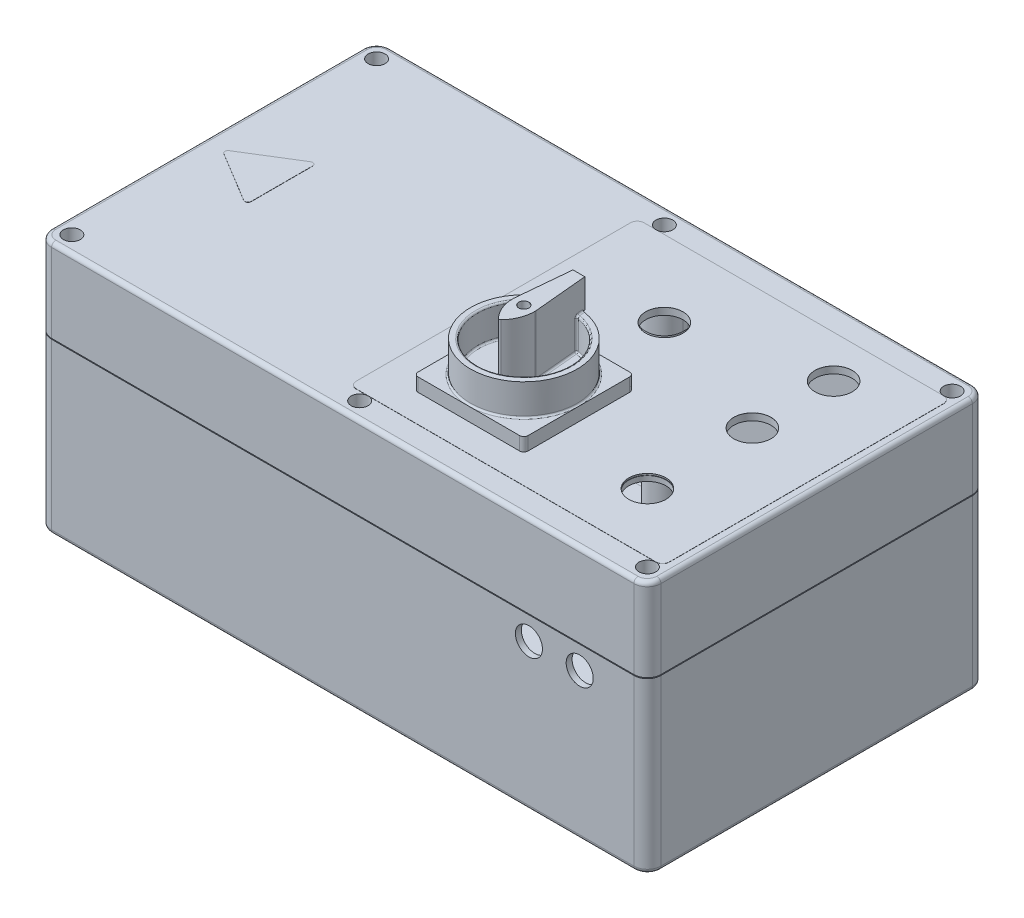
SolidWorks part; units mm, degrees
ref_plane "Plan de face" through (0, 0, 0) normal (0, 0, 1) x (1, 0, 0)
ref_plane "Plan de dessus" through (0, 0, 0) normal (0, 1, 0) x (1, 0, 0)
ref_plane "Plan de droite" through (0, 0, 0) normal (1, 0, 0) x (0, 0, -1)
imported_body "Stock-PMDPRO-5s2-1"
imported_body "Stock-PMDPRO-5s2-2"
sketch "Esquisse1" plane through (0, 40, 0) normal (0, 1, 0) x (1, 0, 0)
  line L4 (181, -346.9491) -> (525, -346.9491)
  line L5 (533, -338.9491) -> (533, -154.9491)
  line L6 (525, -146.9491) -> (181, -146.9491)
  line L7 (173, -154.9491) -> (173, -338.9491)
  line L8 (181, -346.9491) -> (525, -346.9491)
  line L9 (533, -338.9491) -> (533, -154.9491)
  line L10 (525, -146.9491) -> (181, -146.9491)
  line L11 (173, -154.9491) -> (173, -338.9491)
  arc A4 (173, -338.9491) -> (181, -346.9491) centre (181, -338.9491) ccw
  arc A5 (525, -346.9491) -> (533, -338.9491) centre (525, -338.9491) ccw
  arc A6 (533, -154.9491) -> (525, -146.9491) centre (525, -154.9491) ccw
  arc A7 (181, -146.9491) -> (173, -154.9491) centre (181, -154.9491) ccw
  arc A8 (173, -338.9491) -> (181, -346.9491) centre (181, -338.9491) ccw
  arc A9 (525, -346.9491) -> (533, -338.9491) centre (525, -338.9491) ccw
  arc A10 (533, -154.9491) -> (525, -146.9491) centre (525, -154.9491) ccw
  arc A11 (181, -146.9491) -> (173, -154.9491) centre (181, -154.9491) ccw
  dimension "D1" = 0
extrude "Enlèv. mat.-Extru.1" cut sketch "Esquisse1" along normal up to vertex
sketch "Esquisse2" plane through (0, 40, 0) normal (0, 1, 0) x (1, 0, 0)
  line L0 (362.5, -156.9491) -> (362.5, -153.9491)
  line L1 (366, -150.4491) -> (509.5, -150.4491)
  line L2 (513, -153.9491) -> (513, -167.4491)
  line L3 (522.5, -176.9491) -> (526, -176.9491)
  line L4 (529.5, -180.4491) -> (529.5, -313.4491)
  line L5 (525, -146.9491) -> (181, -146.9491) construction
  line L6 (533, -338.9491) -> (533, -154.9491) construction
  line L7 (353, -156.9491) -> (353, -246.9491) construction
  line L8 (353, -246.9491) -> (533, -246.9491) construction
  line L9 (183.5, -176.9491) -> (180, -176.9491)
  line L10 (193, -153.9491) -> (193, -167.4491)
  line L11 (340, -150.4491) -> (196.5, -150.4491)
  line L12 (343.5, -156.9491) -> (343.5, -153.9491)
  line L13 (343.5, -336.9491) -> (343.5, -339.9491)
  line L14 (340, -343.4491) -> (196.5, -343.4491)
  line L15 (193, -339.9491) -> (193, -326.4491)
  line L16 (183.5, -316.9491) -> (180, -316.9491)
  line L17 (522.5, -316.9491) -> (526, -316.9491)
  line L18 (513, -339.9491) -> (513, -326.4491)
  line L19 (366, -343.4491) -> (509.5, -343.4491)
  line L20 (362.5, -336.9491) -> (362.5, -339.9491)
  line L21 (176.5, -180.4491) -> (176.5, -313.4491)
  arc A0 (343.5, -156.9491) -> (362.5, -156.9491) centre (353, -156.9491) ccw
  arc A1 (362.5, -153.9491) -> (366, -150.4491) centre (366, -153.9491) cw
  arc A2 (526, -176.9491) -> (529.5, -180.4491) centre (526, -180.4491) cw
  arc A3 (509.5, -150.4491) -> (513, -153.9491) centre (509.5, -153.9491) cw
  arc A4 (513, -167.4491) -> (522.5, -176.9491) centre (522.5, -167.4491) ccw
  circle A5 centre (523, -156.9491) radius 3
  circle A6 centre (183, -156.9491) radius 3
  arc A7 (193, -167.4491) -> (183.5, -176.9491) centre (183.5, -167.4491) cw
  arc A8 (196.5, -150.4491) -> (193, -153.9491) centre (196.5, -153.9491) ccw
  arc A9 (180, -176.9491) -> (176.5, -180.4491) centre (180, -180.4491) ccw
  arc A10 (343.5, -153.9491) -> (340, -150.4491) centre (340, -153.9491) ccw
  circle A11 centre (353, -156.9491) radius 3
  circle A12 centre (353, -336.9491) radius 3
  arc A13 (343.5, -339.9491) -> (340, -343.4491) centre (340, -339.9491) cw
  arc A14 (180, -316.9491) -> (176.5, -313.4491) centre (180, -313.4491) cw
  arc A15 (196.5, -343.4491) -> (193, -339.9491) centre (196.5, -339.9491) cw
  arc A16 (193, -326.4491) -> (183.5, -316.9491) centre (183.5, -326.4491) ccw
  circle A17 centre (183, -336.9491) radius 3
  circle A18 centre (523, -336.9491) radius 3
  arc A19 (513, -326.4491) -> (522.5, -316.9491) centre (522.5, -326.4491) cw
  arc A20 (509.5, -343.4491) -> (513, -339.9491) centre (509.5, -339.9491) ccw
  arc A21 (526, -316.9491) -> (529.5, -313.4491) centre (526, -313.4491) ccw
  arc A22 (362.5, -339.9491) -> (366, -343.4491) centre (366, -339.9491) ccw
  arc A23 (343.5, -336.9491) -> (362.5, -336.9491) centre (353, -336.9491) cw
  dimension "D2" = 3.5
  dimension "D5" = 19
  dimension "D9" = 3.5
  dimension "D10" = 9.5
  dimension "D11" = 6
  dimension "D1" = 160
  dimension "D3" = 3.5
  dimension "D4" = 180
  dimension "D6" = 10
  dimension "D7" = 30
  dimension "D8" = 3.5
  dimension "D12" = 10
  dimension "D13" = 10
extrude "Enlèv. mat.-Extru.2" cut sketch "Esquisse2" against normal blind 96.5
sketch "Esquisse3" plane through (0, 40, 0) normal (0, 1, 0) x (1, 0, 0)
  line L0 (529.5, -180.4491) -> (529.5, -313.4491) construction
  line L1 (522.5, -176.9491) -> (526, -176.9491) construction
  line L2 (513, -153.9491) -> (513, -167.4491) construction
  line L3 (366, -150.4491) -> (509.5, -150.4491) construction
  line L4 (362.5, -156.9491) -> (362.5, -153.9491) construction
  line L5 (343.5, -156.9491) -> (343.5, -153.9491) construction
  line L6 (340, -150.4491) -> (196.5, -150.4491) construction
  line L7 (193, -153.9491) -> (193, -167.4491) construction
  line L8 (183.5, -176.9491) -> (180, -176.9491) construction
  line L9 (176.5, -180.4491) -> (176.5, -313.4491) construction
  line L10 (183.5, -316.9491) -> (180, -316.9491) construction
  line L11 (193, -339.9491) -> (193, -326.4491) construction
  line L12 (340, -343.4491) -> (196.5, -343.4491) construction
  line L13 (343.5, -336.9491) -> (343.5, -339.9491) construction
  line L14 (362.5, -336.9491) -> (362.5, -339.9491) construction
  line L15 (366, -343.4491) -> (509.5, -343.4491) construction
  line L16 (513, -339.9491) -> (513, -326.4491) construction
  line L17 (522.5, -316.9491) -> (526, -316.9491) construction
  line L18 (529.5, -180.4491) -> (529.5, -313.4491)
  line L19 (522.5, -176.9491) -> (526, -176.9491)
  line L20 (513, -153.9491) -> (513, -167.4491)
  line L21 (366, -150.4491) -> (509.5, -150.4491)
  line L22 (362.5, -156.9491) -> (362.5, -153.9491)
  line L23 (343.5, -156.9491) -> (343.5, -153.9491)
  line L24 (340, -150.4491) -> (196.5, -150.4491)
  line L25 (193, -153.9491) -> (193, -167.4491)
  line L26 (183.5, -176.9491) -> (180, -176.9491)
  line L27 (176.5, -180.4491) -> (176.5, -313.4491)
  line L28 (183.5, -316.9491) -> (180, -316.9491)
  line L29 (193, -339.9491) -> (193, -326.4491)
  line L30 (340, -343.4491) -> (196.5, -343.4491)
  line L31 (343.5, -336.9491) -> (343.5, -339.9491)
  line L32 (362.5, -336.9491) -> (362.5, -339.9491)
  line L33 (366, -343.4491) -> (509.5, -343.4491)
  line L34 (513, -339.9491) -> (513, -326.4491)
  line L35 (522.5, -316.9491) -> (526, -316.9491)
  line L36 (530.5, -180.4491) -> (530.5, -313.4491)
  line L37 (522.5, -317.9491) -> (526, -317.9491)
  line L38 (514, -339.9491) -> (514, -326.4491)
  line L39 (366, -344.4491) -> (509.5, -344.4491)
  line L40 (361.5, -336.9491) -> (361.5, -339.9491)
  line L41 (344.5, -336.9491) -> (344.5, -339.9491)
  line L42 (340, -344.4491) -> (196.5, -344.4491)
  line L43 (192, -339.9491) -> (192, -326.4491)
  line L44 (183.5, -317.9491) -> (180, -317.9491)
  line L45 (175.5, -180.4491) -> (175.5, -313.4491)
  line L46 (183.5, -175.9491) -> (180, -175.9491)
  line L47 (192, -153.9491) -> (192, -167.4491)
  line L48 (340, -149.4491) -> (196.5, -149.4491)
  line L49 (344.5, -156.9491) -> (344.5, -153.9491)
  line L50 (361.5, -156.9491) -> (361.5, -153.9491)
  line L51 (366, -149.4491) -> (509.5, -149.4491)
  line L52 (514, -153.9491) -> (514, -167.4491)
  line L53 (522.5, -175.9491) -> (526, -175.9491)
  arc A6 (529.5, -180.4491) -> (526, -176.9491) centre (526, -180.4491) ccw construction
  arc A7 (513, -167.4491) -> (522.5, -176.9491) centre (522.5, -167.4491) ccw construction
  arc A8 (513, -153.9491) -> (509.5, -150.4491) centre (509.5, -153.9491) ccw construction
  arc A9 (366, -150.4491) -> (362.5, -153.9491) centre (366, -153.9491) ccw construction
  arc A10 (343.5, -156.9491) -> (362.5, -156.9491) centre (353, -156.9491) ccw construction
  arc A11 (343.5, -153.9491) -> (340, -150.4491) centre (340, -153.9491) ccw construction
  arc A12 (196.5, -150.4491) -> (193, -153.9491) centre (196.5, -153.9491) ccw construction
  arc A13 (183.5, -176.9491) -> (193, -167.4491) centre (183.5, -167.4491) ccw construction
  arc A14 (180, -176.9491) -> (176.5, -180.4491) centre (180, -180.4491) ccw construction
  arc A15 (176.5, -313.4491) -> (180, -316.9491) centre (180, -313.4491) ccw construction
  arc A16 (193, -326.4491) -> (183.5, -316.9491) centre (183.5, -326.4491) ccw construction
  arc A17 (193, -339.9491) -> (196.5, -343.4491) centre (196.5, -339.9491) ccw construction
  arc A18 (340, -343.4491) -> (343.5, -339.9491) centre (340, -339.9491) ccw construction
  arc A19 (362.5, -336.9491) -> (343.5, -336.9491) centre (353, -336.9491) ccw construction
  arc A20 (362.5, -339.9491) -> (366, -343.4491) centre (366, -339.9491) ccw construction
  arc A21 (509.5, -343.4491) -> (513, -339.9491) centre (509.5, -339.9491) ccw construction
  arc A22 (522.5, -316.9491) -> (513, -326.4491) centre (522.5, -326.4491) ccw construction
  arc A23 (526, -316.9491) -> (529.5, -313.4491) centre (526, -313.4491) ccw construction
  arc A24 (526, -317.9491) -> (530.5, -313.4491) centre (526, -313.4491) ccw
  arc A25 (522.5, -317.9491) -> (514, -326.4491) centre (522.5, -326.4491) ccw
  arc A26 (509.5, -344.4491) -> (514, -339.9491) centre (509.5, -339.9491) ccw
  arc A27 (361.5, -339.9491) -> (366, -344.4491) centre (366, -339.9491) ccw
  arc A28 (361.5, -336.9491) -> (344.5, -336.9491) centre (353, -336.9491) ccw
  arc A29 (340, -344.4491) -> (344.5, -339.9491) centre (340, -339.9491) ccw
  arc A30 (529.5, -180.4491) -> (526, -176.9491) centre (526, -180.4491) ccw
  arc A31 (513, -167.4491) -> (522.5, -176.9491) centre (522.5, -167.4491) ccw
  arc A32 (513, -153.9491) -> (509.5, -150.4491) centre (509.5, -153.9491) ccw
  arc A33 (366, -150.4491) -> (362.5, -153.9491) centre (366, -153.9491) ccw
  arc A34 (343.5, -156.9491) -> (362.5, -156.9491) centre (353, -156.9491) ccw
  arc A35 (343.5, -153.9491) -> (340, -150.4491) centre (340, -153.9491) ccw
  arc A36 (196.5, -150.4491) -> (193, -153.9491) centre (196.5, -153.9491) ccw
  arc A37 (183.5, -176.9491) -> (193, -167.4491) centre (183.5, -167.4491) ccw
  arc A38 (180, -176.9491) -> (176.5, -180.4491) centre (180, -180.4491) ccw
  arc A39 (176.5, -313.4491) -> (180, -316.9491) centre (180, -313.4491) ccw
  arc A40 (193, -326.4491) -> (183.5, -316.9491) centre (183.5, -326.4491) ccw
  arc A41 (193, -339.9491) -> (196.5, -343.4491) centre (196.5, -339.9491) ccw
  arc A42 (340, -343.4491) -> (343.5, -339.9491) centre (340, -339.9491) ccw
  arc A43 (362.5, -336.9491) -> (343.5, -336.9491) centre (353, -336.9491) ccw
  arc A44 (362.5, -339.9491) -> (366, -343.4491) centre (366, -339.9491) ccw
  arc A45 (509.5, -343.4491) -> (513, -339.9491) centre (509.5, -339.9491) ccw
  arc A46 (522.5, -316.9491) -> (513, -326.4491) centre (522.5, -326.4491) ccw
  arc A47 (526, -316.9491) -> (529.5, -313.4491) centre (526, -313.4491) ccw
  arc A48 (192, -339.9491) -> (196.5, -344.4491) centre (196.5, -339.9491) ccw
  arc A49 (192, -326.4491) -> (183.5, -317.9491) centre (183.5, -326.4491) ccw
  arc A50 (175.5, -313.4491) -> (180, -317.9491) centre (180, -313.4491) ccw
  arc A51 (180, -175.9491) -> (175.5, -180.4491) centre (180, -180.4491) ccw
  arc A52 (183.5, -175.9491) -> (192, -167.4491) centre (183.5, -167.4491) ccw
  arc A53 (196.5, -149.4491) -> (192, -153.9491) centre (196.5, -153.9491) ccw
  arc A54 (344.5, -153.9491) -> (340, -149.4491) centre (340, -153.9491) ccw
  arc A55 (344.5, -156.9491) -> (361.5, -156.9491) centre (353, -156.9491) ccw
  arc A56 (366, -149.4491) -> (361.5, -153.9491) centre (366, -153.9491) ccw
  arc A57 (514, -153.9491) -> (509.5, -149.4491) centre (509.5, -153.9491) ccw
  arc A58 (514, -167.4491) -> (522.5, -175.9491) centre (522.5, -167.4491) ccw
  arc A59 (530.5, -180.4491) -> (526, -175.9491) centre (526, -180.4491) ccw
  dimension "D1" = 1
extrude "Boss.-Extru.1" add sketch "Esquisse3" along normal blind 1.5
sketch "Esquisse4" plane through (0, 40, 0) normal (0, 1, 0) x (1, 0, 0)
  line L0 (533, -338.9491) -> (533, -154.9491) construction
  line L1 (525, -146.9491) -> (181, -146.9491) construction
  line L2 (522.5, -173.7491) -> (528.5, -173.7491)
  line L3 (529.5, -172.7491) -> (529.5, -162.7586)
  line L5 (516.2, -167.4491) -> (516.2, -162.4591)
  line L6 (353, -159.9491) -> (353, -246.9491) construction
  line L7 (529.5, -246.9491) -> (353, -246.9491) construction
  line L8 (529.5, -313.4491) -> (529.5, -180.4491) construction
  line L9 (516.2, -326.4491) -> (516.2, -331.4391)
  line L10 (529.5, -321.1491) -> (529.5, -331.1396)
  line L11 (522.5, -320.1491) -> (528.5, -320.1491)
  line L12 (183.5, -320.1491) -> (177.5, -320.1491)
  line L13 (176.5, -321.1491) -> (176.5, -331.1396)
  line L14 (189.8, -326.4491) -> (189.8, -331.4391)
  line L15 (189.8, -167.4491) -> (189.8, -162.4591)
  line L16 (176.5, -172.7491) -> (176.5, -162.7586)
  line L17 (183.5, -173.7491) -> (177.5, -173.7491)
  arc A0 (517.925, -161.7703) -> (527.8125, -162.0324) centre (523, -156.9491) ccw
  circle A1 centre (523, -168.9491) radius 4.7 construction
  arc A3 (529.5, -172.7491) -> (528.5, -173.7491) centre (528.5, -172.7491) cw
  arc A4 (516.2, -167.4491) -> (522.5, -173.7491) centre (522.5, -167.4491) ccw
  arc A5 (516.2, -167.4491) -> (522.5, -173.7491) centre (522.5, -167.4491) ccw
  arc A6 (529.5, -162.7586) -> (527.8125, -162.0324) centre (528.5, -162.7586) ccw
  arc A7 (516.2, -162.4591) -> (517.925, -161.7703) centre (517.2, -162.4591) cw
  circle A8 centre (353, -156.9491) radius 3 construction
  circle A9 centre (353, -156.9491) radius 3 construction
  circle A11 centre (523, -324.9491) radius 4.7 construction
  arc A12 (516.2, -331.4391) -> (517.925, -332.1279) centre (517.2, -331.4391) ccw
  arc A13 (529.5, -331.1396) -> (527.8125, -331.8658) centre (528.5, -331.1396) cw
  arc A14 (516.2, -326.4491) -> (522.5, -320.1491) centre (522.5, -326.4491) cw
  arc A15 (529.5, -321.1491) -> (528.5, -320.1491) centre (528.5, -321.1491) ccw
  arc A16 (517.925, -332.1279) -> (527.8125, -331.8658) centre (523, -336.9491) cw
  circle A17 centre (183, -324.9491) radius 4.7 construction
  circle A18 centre (183, -168.9491) radius 4.7 construction
  arc A19 (188.075, -332.1279) -> (178.1875, -331.8658) centre (183, -336.9491) ccw
  arc A20 (176.5, -321.1491) -> (177.5, -320.1491) centre (177.5, -321.1491) cw
  arc A21 (189.8, -326.4491) -> (183.5, -320.1491) centre (183.5, -326.4491) ccw
  arc A22 (176.5, -331.1396) -> (178.1875, -331.8658) centre (177.5, -331.1396) ccw
  arc A23 (189.8, -331.4391) -> (188.075, -332.1279) centre (188.8, -331.4391) cw
  arc A24 (189.8, -162.4591) -> (188.075, -161.7703) centre (188.8, -162.4591) ccw
  arc A25 (176.5, -162.7586) -> (178.1875, -162.0324) centre (177.5, -162.7586) cw
  arc A26 (189.8, -167.4491) -> (183.5, -173.7491) centre (183.5, -167.4491) cw
  arc A27 (176.5, -172.7491) -> (177.5, -173.7491) centre (177.5, -172.7491) ccw
  arc A28 (188.075, -161.7703) -> (178.1875, -162.0324) centre (183, -156.9491) cw
  dimension "D1" = 9.4
  dimension "D5" = 14
  dimension "D6" = 1
  dimension "D8" = 1
  dimension "D9" = 1
  dimension "D2" = 10
  dimension "D3" = 22
  dimension "D7" = 3.5
  dimension "D4" = 3.2
extrude "Enlèv. mat.-Extru.3" cut sketch "Esquisse4" against normal blind 90
sketch "Esquisse5" plane through (0, -60, 0) normal (0, -1, 0) x (1, 0, 0)
  circle A0 centre (183, 168.9491) radius 5.5
  circle A1 centre (183, 168.9491) radius 3.25 construction
  circle A2 centre (183, 168.9491) radius 3.25
  circle A3 centre (183, 324.9491) radius 3.25 construction
  circle A4 centre (523, 324.9491) radius 3.25 construction
  circle A5 centre (523, 168.9491) radius 3.25 construction
  circle A6 centre (183, 324.9491) radius 3.25
  circle A7 centre (523, 324.9491) radius 3.25
  circle A8 centre (523, 168.9491) radius 3.25
  circle A9 centre (523, 324.9491) radius 5.5
  circle A10 centre (183, 324.9491) radius 5.5
  circle A11 centre (523, 168.9491) radius 5.5
  dimension "D1" = 11
extrude "Boss.-Extru.2" add sketch "Esquisse5" along normal blind 1.25
sketch "Esquisse6" plane through (0, -56.5, 0) normal (0, 1, 0) x (1, 0, 0)
  line L0 (353, -165.4491) -> (353, -328.4491) construction
  line L1 (525, -146.9491) -> (181, -146.9491) construction
  circle A0 centre (518, -206.9491) radius 2.75 construction
  circle A1 centre (503.5, -160.9491) radius 2.75 construction
  circle A2 centre (518, -246.9491) radius 2.75 construction
  circle A3 centre (518, -286.9491) radius 2.75 construction
  circle A4 centre (503.5, -332.9491) radius 2.75 construction
  circle A5 centre (518, -206.9491) radius 2.75
  circle A6 centre (503.5, -160.9491) radius 2.75
  circle A7 centre (518, -246.9491) radius 2.75
  circle A8 centre (518, -286.9491) radius 2.75
  circle A9 centre (503.5, -332.9491) radius 2.75
  circle A10 centre (503.5, -160.9491) radius 5.75
  circle A11 centre (518, -206.9491) radius 5.75
  circle A12 centre (518, -246.9491) radius 5.75
  circle A13 centre (518, -286.9491) radius 5.75
  circle A14 centre (503.5, -332.9491) radius 5.75
  circle A15 centre (518, -237.9491) radius 1.5
  circle A16 centre (518, -255.9491) radius 1.5
  arc A17 (344.5, -156.9491) -> (361.5, -156.9491) centre (353, -156.9491) ccw construction
  arc A18 (361.5, -336.9491) -> (344.5, -336.9491) centre (353, -336.9491) ccw construction
  circle A19 centre (188, -255.9491) radius 1.5
  circle A20 centre (188, -237.9491) radius 1.5
  circle A21 centre (202.5, -332.9491) radius 5.75
  circle A22 centre (188, -286.9491) radius 5.75
  circle A23 centre (188, -246.9491) radius 5.75
  circle A24 centre (188, -206.9491) radius 5.75
  circle A25 centre (202.5, -160.9491) radius 5.75
  circle A26 centre (202.5, -332.9491) radius 2.75
  circle A27 centre (188, -286.9491) radius 2.75
  circle A28 centre (188, -246.9491) radius 2.75
  circle A29 centre (202.5, -160.9491) radius 2.75
  circle A30 centre (188, -206.9491) radius 2.75
  circle A31 centre (353, -176.9491) radius 1.5
  circle A32 centre (353, -316.9491) radius 1.5
  dimension "D1" = 11.5
  dimension "D4" = 3
  dimension "D5" = 3
  dimension "D8" = 3
  dimension "D9" = 3
  dimension "D2" = 9
  dimension "D3" = 9
  dimension "D6" = 140
  dimension "D7" = 30
extrude "Boss.-Extru.3" add sketch "Esquisse6" along normal blind 10
fillet "Congé1" radius 1 52 edges at (353, -56.5, 315.4491) (202.5, -56.5, 155.1991) (188, -56.5, 241.1991) (202.5, -56.5, 327.1991) (188, -56.5, 254.4491) (518, -56.5, 236.4491) (518, -56.5, 281.1991) (518, -56.5, 201.1991) (529.5, -56.5, 246.9491) (528.4749, -56.5, 315.924) (524.25, -56.5, 316.9491) (515.7825, -56.5, 319.7316) (513, -56.5, 333.1991) (511.9749, -56.5, 342.424) (437.75, -56.5, 343.4491) (363.5251, -56.5, 342.424) (362.5, -56.5, 338.4491) (353, -56.5, 327.4491) (343.5, -56.5, 338.4491) (342.4749, -56.5, 342.424) (268.25, -56.5, 343.4491) (194.0251, -56.5, 342.424) (193, -56.5, 333.1991) (190.2175, -56.5, 319.7316) (181.75, -56.5, 316.9491) (177.5251, -56.5, 315.924) (176.5, -56.5, 246.9491) (177.5251, -56.5, 177.9742) (181.75, -56.5, 176.9491) (190.2175, -56.5, 174.1666) (193, -56.5, 160.6991) (194.0251, -56.5, 151.4742) (268.25, -56.5, 150.4491) (342.4749, -56.5, 151.4742) (343.5, -56.5, 155.4491) (353, -56.5, 166.4491) (362.5, -56.5, 155.4491) (363.5251, -56.5, 151.4742) (437.75, -56.5, 150.4491) (511.9749, -56.5, 151.4742) (513, -56.5, 160.6991) (515.7825, -56.5, 174.1666) (524.25, -56.5, 176.9491) (528.4749, -56.5, 177.9742) (503.5, -56.5, 155.1991) (518, -56.5, 241.1991) (503.5, -56.5, 327.1991) (518, -56.5, 254.4491) (188, -56.5, 236.4491) (188, -56.5, 281.1991) (188, -56.5, 201.1991) (353, -56.5, 175.4491)
sketch "Esquisse7" plane through (0, 89.5, 0) normal (0, 1, 0) x (1, 0, 0)
  line L0 (483, -186.9491) -> (483, -234.9491) construction
  line L1 (525, -146.9491) -> (181, -146.9491) construction
  line L2 (466, -171.9491) -> (506, -171.9491) construction
  line L3 (466, -171.9491) -> (466, -201.9491) construction
  line L4 (466, -201.9491) -> (506, -201.9491) construction
  line L5 (506, -171.9491) -> (506, -201.9491) construction
  line L6 (533, -338.9491) -> (533, -154.9491) construction
  circle A0 centre (483, -296.9491) radius 11
  circle A1 centre (483, -186.9491) radius 11
  circle A2 centre (483, -234.9491) radius 11
  circle A3 centre (403, -206.9491) radius 11
  dimension "D1" = 22
  dimension "D2" = 22
  dimension "D11" = 22
  dimension "D3" = 30
  dimension "D4" = 40
  dimension "D5" = 15
  dimension "D6" = 17
  dimension "D7" = 40
  dimension "D8" = 50
  dimension "D9" = 48
  dimension "D10" = 80
  dimension "D12" = 60
extrude "Enlèv. mat.-Extru.5" cut sketch "Esquisse7" against normal blind 10
sketch "Esquisse8" plane through (0, 89.5, 0) normal (0, 1, 0) x (1, 0, 0)
  line L0 (181, -146.9491) -> (525, -146.9491) construction
  line L1 (523, -161.9491) -> (346, -161.9491)
  line L2 (527, -165.9491) -> (527, -327.9491)
  line L3 (523, -331.9491) -> (346, -331.9491)
  line L4 (342, -165.9491) -> (342, -327.9491)
  line L5 (533, -154.9491) -> (533, -338.9491) construction
  arc A0 (346, -161.9491) -> (342, -165.9491) centre (346, -165.9491) ccw
  arc A1 (346, -331.9491) -> (342, -327.9491) centre (346, -327.9491) cw
  arc A2 (527, -327.9491) -> (523, -331.9491) centre (523, -327.9491) cw
  arc A3 (523, -161.9491) -> (527, -165.9491) centre (523, -165.9491) cw
  circle A4 centre (483, -296.9491) radius 11 construction
  circle A5 centre (483, -296.9491) radius 11
  circle A6 centre (483, -186.9491) radius 11 construction
  circle A7 centre (483, -234.9491) radius 11
  circle A8 centre (483, -234.9491) radius 11
  circle A9 centre (403, -206.9491) radius 11 construction
  circle A10 centre (483, -186.9491) radius 11
  circle A11 centre (403, -206.9491) radius 11
  circle A12 centre (396, -282.9491) radius 6 construction
  circle A13 centre (378, -264.9491) radius 2.5 construction
  circle A14 centre (414, -300.9491) radius 2.5 construction
  circle A15 centre (378, -300.9491) radius 2.5 construction
  circle A16 centre (414, -264.9491) radius 2.5 construction
  circle A17 centre (396, -282.9491) radius 6
  circle A18 centre (378, -264.9491) radius 2.5
  circle A19 centre (414, -300.9491) radius 2.5
  circle A20 centre (378, -300.9491) radius 2.5
  circle A21 centre (414, -264.9491) radius 2.5
  point P10 (342, -161.9491)
  point P15 (527, -331.9491)
  point P18 (527, -161.9491)
  dimension "D5" = 4
  dimension "D1" = 185
  dimension "D2" = 170
  dimension "D3" = 15
  dimension "D4" = 6
  dimension "D6" = 0
extrude "Boss.-Extru.4" add sketch "Esquisse8" along normal blind 0.1
sketch "Esquisse9" plane through (0, 40, 0) normal (0, 1, 0) x (1, 0, 0)
  line L0 (529.5, -313.4491) -> (529.5, -180.4491)
  line L1 (526, -176.9491) -> (522.5, -176.9491)
  line L2 (513, -167.4491) -> (513, -153.9491)
  line L3 (509.5, -150.4491) -> (366, -150.4491)
  line L4 (362.5, -153.9491) -> (362.5, -156.9491)
  line L5 (343.5, -156.9491) -> (343.5, -153.9491)
  line L6 (340, -150.4491) -> (196.5, -150.4491)
  line L7 (193, -153.9491) -> (193, -167.4491)
  line L8 (183.5, -176.9491) -> (180, -176.9491)
  line L9 (176.5, -180.4491) -> (176.5, -313.4491)
  line L10 (180, -316.9491) -> (183.5, -316.9491)
  line L11 (193, -326.4491) -> (193, -339.9491)
  line L12 (196.5, -343.4491) -> (340, -343.4491)
  line L13 (343.5, -339.9491) -> (343.5, -336.9491)
  line L14 (362.5, -336.9491) -> (362.5, -339.9491)
  line L15 (366, -343.4491) -> (509.5, -343.4491)
  line L16 (513, -339.9491) -> (513, -326.4491)
  line L17 (522.5, -316.9491) -> (526, -316.9491)
  line L18 (526, -175.9491) -> (522.5, -175.9491)
  line L19 (514, -167.4491) -> (514, -153.9491)
  line L20 (509.5, -149.4491) -> (366, -149.4491)
  line L21 (361.5, -153.9491) -> (361.5, -156.9491)
  line L22 (344.5, -156.9491) -> (344.5, -153.9491)
  line L23 (340, -149.4491) -> (196.5, -149.4491)
  line L24 (192, -153.9491) -> (192, -167.4491)
  line L25 (183.5, -175.9491) -> (180, -175.9491)
  line L26 (175.5, -180.4491) -> (175.5, -313.4491)
  line L27 (180, -317.9491) -> (183.5, -317.9491)
  line L28 (192, -326.4491) -> (192, -339.9491)
  line L29 (196.5, -344.4491) -> (340, -344.4491)
  line L30 (344.5, -339.9491) -> (344.5, -336.9491)
  line L31 (361.5, -336.9491) -> (361.5, -339.9491)
  line L32 (366, -344.4491) -> (509.5, -344.4491)
  line L33 (514, -339.9491) -> (514, -326.4491)
  line L34 (522.5, -317.9491) -> (526, -317.9491)
  line L35 (530.5, -313.4491) -> (530.5, -180.4491)
  line L36 (526, -175.9491) -> (522.5, -175.9491)
  line L37 (514, -167.4491) -> (514, -153.9491)
  line L38 (509.5, -149.4491) -> (366, -149.4491)
  line L39 (361.5, -153.9491) -> (361.5, -156.9491)
  line L40 (344.5, -156.9491) -> (344.5, -153.9491)
  line L41 (340, -149.4491) -> (196.5, -149.4491)
  line L42 (192, -153.9491) -> (192, -167.4491)
  line L43 (183.5, -175.9491) -> (180, -175.9491)
  line L44 (175.5, -180.4491) -> (175.5, -313.4491)
  line L45 (180, -317.9491) -> (183.5, -317.9491)
  line L46 (192, -326.4491) -> (192, -339.9491)
  line L47 (196.5, -344.4491) -> (340, -344.4491)
  line L48 (344.5, -339.9491) -> (344.5, -336.9491)
  line L49 (361.5, -336.9491) -> (361.5, -339.9491)
  line L50 (366, -344.4491) -> (509.5, -344.4491)
  line L51 (514, -339.9491) -> (514, -326.4491)
  line L52 (522.5, -317.9491) -> (526, -317.9491)
  line L53 (530.5, -313.4491) -> (530.5, -180.4491)
  arc A0 (526, -316.9491) -> (529.5, -313.4491) centre (526, -313.4491) ccw
  arc A1 (529.5, -180.4491) -> (526, -176.9491) centre (526, -180.4491) ccw
  arc A2 (513, -167.4491) -> (522.5, -176.9491) centre (522.5, -167.4491) ccw
  arc A3 (513, -153.9491) -> (509.5, -150.4491) centre (509.5, -153.9491) ccw
  arc A4 (366, -150.4491) -> (362.5, -153.9491) centre (366, -153.9491) ccw
  arc A5 (343.5, -156.9491) -> (362.5, -156.9491) centre (353, -156.9491) ccw
  arc A6 (343.5, -153.9491) -> (340, -150.4491) centre (340, -153.9491) ccw
  arc A7 (196.5, -150.4491) -> (193, -153.9491) centre (196.5, -153.9491) ccw
  arc A8 (183.5, -176.9491) -> (193, -167.4491) centre (183.5, -167.4491) ccw
  arc A9 (180, -176.9491) -> (176.5, -180.4491) centre (180, -180.4491) ccw
  arc A10 (176.5, -313.4491) -> (180, -316.9491) centre (180, -313.4491) ccw
  arc A11 (193, -326.4491) -> (183.5, -316.9491) centre (183.5, -326.4491) ccw
  arc A12 (193, -339.9491) -> (196.5, -343.4491) centre (196.5, -339.9491) ccw
  arc A13 (340, -343.4491) -> (343.5, -339.9491) centre (340, -339.9491) ccw
  arc A14 (362.5, -336.9491) -> (343.5, -336.9491) centre (353, -336.9491) ccw
  arc A15 (362.5, -339.9491) -> (366, -343.4491) centre (366, -339.9491) ccw
  arc A16 (509.5, -343.4491) -> (513, -339.9491) centre (509.5, -339.9491) ccw
  arc A17 (522.5, -316.9491) -> (513, -326.4491) centre (522.5, -326.4491) ccw
  arc A18 (530.5, -180.4491) -> (526, -175.9491) centre (526, -180.4491) ccw
  arc A19 (514, -167.4491) -> (522.5, -175.9491) centre (522.5, -167.4491) ccw
  arc A20 (514, -153.9491) -> (509.5, -149.4491) centre (509.5, -153.9491) ccw
  arc A21 (366, -149.4491) -> (361.5, -153.9491) centre (366, -153.9491) ccw
  arc A22 (344.5, -156.9491) -> (361.5, -156.9491) centre (353, -156.9491) ccw
  arc A23 (344.5, -153.9491) -> (340, -149.4491) centre (340, -153.9491) ccw
  arc A24 (196.5, -149.4491) -> (192, -153.9491) centre (196.5, -153.9491) ccw
  arc A25 (183.5, -175.9491) -> (192, -167.4491) centre (183.5, -167.4491) ccw
  arc A26 (180, -175.9491) -> (175.5, -180.4491) centre (180, -180.4491) ccw
  arc A27 (175.5, -313.4491) -> (180, -317.9491) centre (180, -313.4491) ccw
  arc A28 (192, -326.4491) -> (183.5, -317.9491) centre (183.5, -326.4491) ccw
  arc A29 (192, -339.9491) -> (196.5, -344.4491) centre (196.5, -339.9491) ccw
  arc A30 (340, -344.4491) -> (344.5, -339.9491) centre (340, -339.9491) ccw
  arc A31 (361.5, -336.9491) -> (344.5, -336.9491) centre (353, -336.9491) ccw
  arc A32 (361.5, -339.9491) -> (366, -344.4491) centre (366, -339.9491) ccw
  arc A33 (509.5, -344.4491) -> (514, -339.9491) centre (509.5, -339.9491) ccw
  arc A34 (522.5, -317.9491) -> (514, -326.4491) centre (522.5, -326.4491) ccw
  arc A35 (526, -317.9491) -> (530.5, -313.4491) centre (526, -313.4491) ccw
  arc A36 (530.5, -180.4491) -> (526, -175.9491) centre (526, -180.4491) ccw
  arc A37 (514, -167.4491) -> (522.5, -175.9491) centre (522.5, -167.4491) ccw
  arc A38 (514, -153.9491) -> (509.5, -149.4491) centre (509.5, -153.9491) ccw
  arc A39 (366, -149.4491) -> (361.5, -153.9491) centre (366, -153.9491) ccw
  arc A40 (344.5, -156.9491) -> (361.5, -156.9491) centre (353, -156.9491) ccw
  arc A41 (344.5, -153.9491) -> (340, -149.4491) centre (340, -153.9491) ccw
  arc A42 (196.5, -149.4491) -> (192, -153.9491) centre (196.5, -153.9491) ccw
  arc A43 (183.5, -175.9491) -> (192, -167.4491) centre (183.5, -167.4491) ccw
  arc A44 (180, -175.9491) -> (175.5, -180.4491) centre (180, -180.4491) ccw
  arc A45 (175.5, -313.4491) -> (180, -317.9491) centre (180, -313.4491) ccw
  arc A46 (192, -326.4491) -> (183.5, -317.9491) centre (183.5, -326.4491) ccw
  arc A47 (192, -339.9491) -> (196.5, -344.4491) centre (196.5, -339.9491) ccw
  arc A48 (340, -344.4491) -> (344.5, -339.9491) centre (340, -339.9491) ccw
  arc A49 (361.5, -336.9491) -> (344.5, -336.9491) centre (353, -336.9491) ccw
  arc A50 (361.5, -339.9491) -> (366, -344.4491) centre (366, -339.9491) ccw
  arc A51 (509.5, -344.4491) -> (514, -339.9491) centre (509.5, -339.9491) ccw
  arc A52 (522.5, -317.9491) -> (514, -326.4491) centre (522.5, -326.4491) ccw
  arc A53 (526, -317.9491) -> (530.5, -313.4491) centre (526, -313.4491) ccw
  dimension "D1" = 0
  dimension "D2" = 1
extrude "Enlèv. mat.-Extru.6" cut sketch "Esquisse9" along normal blind 2
sketch "Esquisse10" plane through (0, 40.5, 0) normal (0, -1, 0) x (1, 0, 0)
  line L36 (528, 180.4491) -> (528, 313.4491)
  line L37 (526, 315.4491) -> (522.5, 315.4491)
  line L38 (511.5, 326.4491) -> (511.5, 339.9491)
  line L39 (509.5, 341.9491) -> (366, 341.9491)
  line L40 (364, 339.9491) -> (364, 336.9491)
  line L41 (342, 336.9491) -> (342, 339.9491)
  line L42 (340, 341.9491) -> (196.5, 341.9491)
  line L43 (194.5, 339.9491) -> (194.5, 326.4491)
  line L44 (183.5, 315.4491) -> (180, 315.4491)
  line L45 (178, 313.4491) -> (178, 180.4491)
  line L46 (180, 178.4491) -> (183.5, 178.4491)
  line L47 (194.5, 167.4491) -> (194.5, 153.9491)
  line L48 (196.5, 151.9491) -> (340, 151.9491)
  line L49 (342, 153.9491) -> (342, 156.9491)
  line L50 (364, 156.9491) -> (364, 153.9491)
  line L51 (366, 151.9491) -> (509.5, 151.9491)
  line L52 (511.5, 153.9491) -> (511.5, 167.4491)
  line L53 (522.5, 178.4491) -> (526, 178.4491)
  line L54 (528, 180.4491) -> (528, 313.4491)
  line L55 (526, 315.4491) -> (522.5, 315.4491)
  line L56 (511.5, 326.4491) -> (511.5, 339.9491)
  line L57 (509.5, 341.9491) -> (366, 341.9491)
  line L58 (364, 339.9491) -> (364, 336.9491)
  line L59 (342, 336.9491) -> (342, 339.9491)
  line L60 (340, 341.9491) -> (196.5, 341.9491)
  line L61 (194.5, 339.9491) -> (194.5, 326.4491)
  line L62 (183.5, 315.4491) -> (180, 315.4491)
  line L63 (178, 313.4491) -> (178, 180.4491)
  line L64 (180, 178.4491) -> (183.5, 178.4491)
  line L65 (194.5, 167.4491) -> (194.5, 153.9491)
  line L66 (196.5, 151.9491) -> (340, 151.9491)
  line L67 (342, 153.9491) -> (342, 156.9491)
  line L68 (364, 156.9491) -> (364, 153.9491)
  line L69 (366, 151.9491) -> (509.5, 151.9491)
  line L70 (511.5, 153.9491) -> (511.5, 167.4491)
  line L71 (522.5, 178.4491) -> (526, 178.4491)
  arc A36 (528, 313.4491) -> (526, 315.4491) centre (526, 313.4491) ccw
  arc A37 (511.5, 326.4491) -> (522.5, 315.4491) centre (522.5, 326.4491) ccw
  arc A38 (511.5, 339.9491) -> (509.5, 341.9491) centre (509.5, 339.9491) ccw
  arc A39 (366, 341.9491) -> (364, 339.9491) centre (366, 339.9491) ccw
  arc A40 (342, 336.9491) -> (364, 336.9491) centre (353, 336.9491) ccw
  arc A41 (342, 339.9491) -> (340, 341.9491) centre (340, 339.9491) ccw
  arc A42 (196.5, 341.9491) -> (194.5, 339.9491) centre (196.5, 339.9491) ccw
  arc A43 (183.5, 315.4491) -> (194.5, 326.4491) centre (183.5, 326.4491) ccw
  arc A44 (180, 315.4491) -> (178, 313.4491) centre (180, 313.4491) ccw
  arc A45 (178, 180.4491) -> (180, 178.4491) centre (180, 180.4491) ccw
  arc A46 (194.5, 167.4491) -> (183.5, 178.4491) centre (183.5, 167.4491) ccw
  arc A47 (194.5, 153.9491) -> (196.5, 151.9491) centre (196.5, 153.9491) ccw
  arc A48 (340, 151.9491) -> (342, 153.9491) centre (340, 153.9491) ccw
  arc A49 (364, 156.9491) -> (342, 156.9491) centre (353, 156.9491) ccw
  arc A50 (364, 153.9491) -> (366, 151.9491) centre (366, 153.9491) ccw
  arc A51 (509.5, 151.9491) -> (511.5, 153.9491) centre (509.5, 153.9491) ccw
  arc A52 (522.5, 178.4491) -> (511.5, 167.4491) centre (522.5, 167.4491) ccw
  arc A53 (526, 178.4491) -> (528, 180.4491) centre (526, 180.4491) ccw
  arc A54 (528, 313.4491) -> (526, 315.4491) centre (526, 313.4491) ccw
  arc A55 (511.5, 326.4491) -> (522.5, 315.4491) centre (522.5, 326.4491) ccw
  arc A56 (511.5, 339.9491) -> (509.5, 341.9491) centre (509.5, 339.9491) ccw
  arc A57 (366, 341.9491) -> (364, 339.9491) centre (366, 339.9491) ccw
  arc A58 (342, 336.9491) -> (364, 336.9491) centre (353, 336.9491) ccw
  arc A59 (342, 339.9491) -> (340, 341.9491) centre (340, 339.9491) ccw
  arc A60 (196.5, 341.9491) -> (194.5, 339.9491) centre (196.5, 339.9491) ccw
  arc A61 (183.5, 315.4491) -> (194.5, 326.4491) centre (183.5, 326.4491) ccw
  arc A62 (180, 315.4491) -> (178, 313.4491) centre (180, 313.4491) ccw
  arc A63 (178, 180.4491) -> (180, 178.4491) centre (180, 180.4491) ccw
  arc A64 (194.5, 167.4491) -> (183.5, 178.4491) centre (183.5, 167.4491) ccw
  arc A65 (194.5, 153.9491) -> (196.5, 151.9491) centre (196.5, 153.9491) ccw
  arc A66 (340, 151.9491) -> (342, 153.9491) centre (340, 153.9491) ccw
  arc A67 (364, 156.9491) -> (342, 156.9491) centre (353, 156.9491) ccw
  arc A68 (364, 153.9491) -> (366, 151.9491) centre (366, 153.9491) ccw
  arc A69 (509.5, 151.9491) -> (511.5, 153.9491) centre (509.5, 153.9491) ccw
  arc A70 (522.5, 178.4491) -> (511.5, 167.4491) centre (522.5, 167.4491) ccw
  arc A71 (526, 178.4491) -> (528, 180.4491) centre (526, 180.4491) ccw
  dimension "D1" = 1.5
extrude "Enlèv. mat.-Extru.7" cut sketch "Esquisse10" against normal offset from surface (45 mm away) 4
sketch "Esquisse11" plane through (0, 89.5, 0) normal (0, 1, 0) x (1, 0, 0)
  line L1 (317.8889, -137.3118) -> (547.5835, -137.3118)
  line L2 (317.8889, -137.3118) -> (317.8889, -357.4925)
  line L3 (317.8889, -357.4925) -> (547.5835, -357.4925)
  line L4 (547.5835, -137.3118) -> (547.5835, -357.4925)
extrude "Enlèv. mat.-Extru.8" cut sketch "Esquisse11" along normal blind 0.01
sketch "Esquisse12" plane through (0, 89.5, 0) normal (0, 1, 0) x (1, 0, 0)
  line L0 (216.2875, -229.19) -> (186.4975, -247.6314)
  line L1 (186.5141, -250.7025) -> (216.3041, -268.7007)
  line L2 (219.0349, -267.16) -> (219.0349, -230.7205)
  arc A0 (219.0349, -230.7205) -> (216.2875, -229.19) centre (217.2349, -230.7205) ccw
  arc A1 (216.3041, -268.7007) -> (219.0349, -267.16) centre (217.2349, -267.16) ccw
  arc A2 (186.4975, -247.6314) -> (186.5141, -250.7025) centre (187.4449, -249.1619) ccw
  dimension "D1" = 1.8
extrude "Boss.-Extru.5" add sketch "Esquisse12" along normal blind 0.1
